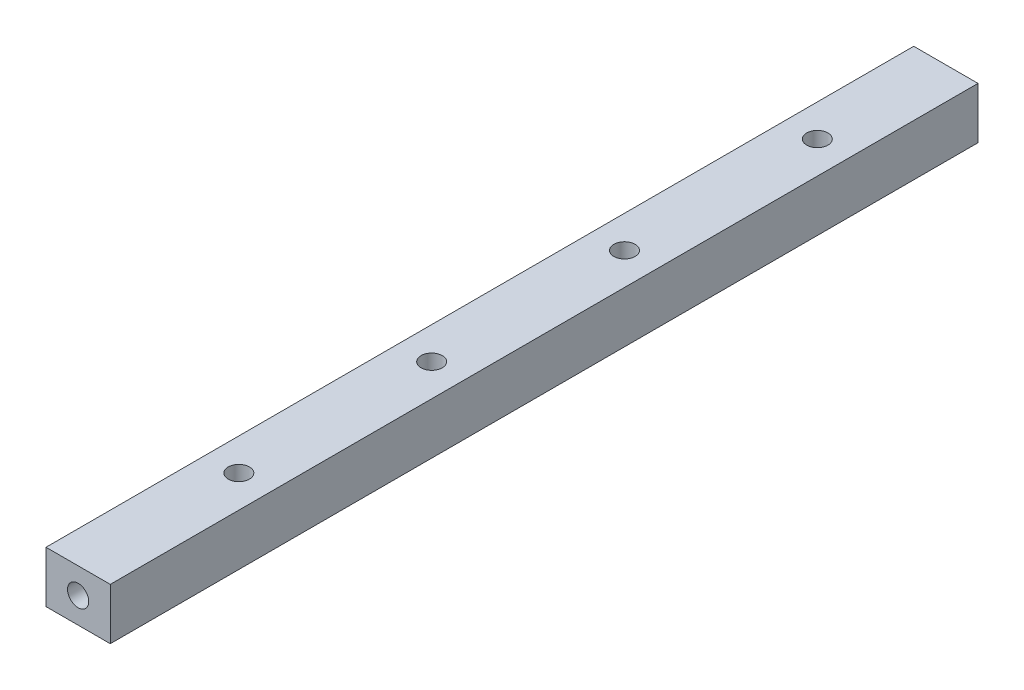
SolidWorks part; units mm, degrees
ref_plane "Plan de face" through (0, 0, 0) normal (0, 0, 1) x (1, 0, 0)
ref_plane "Plan de dessus" through (0, 0, 0) normal (0, 1, 0) x (1, 0, 0)
ref_plane "Plan de droite" through (0, 0, 0) normal (1, 0, 0) x (0, 0, -1)
sketch "Esquisse1" plane through (0, 0, 0) normal (0, 0, 1) x (1, 0, 0)
  line L1 (-5, 4) -> (5, 4)
  line L2 (-5, 4) -> (-5, -4)
  line L3 (-5, -4) -> (5, -4)
  line L4 (5, 4) -> (5, -4)
  dimension "D1" = 8
  dimension "D2" = 4
  dimension "D3" = 5
  dimension "D4" = 10
extrude "Boss.-Extru.1" add sketch "Esquisse1" along normal blind 135
hole_wizard "Trou taraudé M41" positions "Esquisse4" profile "Esquisse3" tap size "M4" standard "ISO"
sketch "Esquisse4" plane through (0, 0, 135) normal (0, 0, 1) x (1, 0, 0)
  point P0 (0, 0)
sketch "Esquisse3" plane through (0, 0, 135) normal (1, 0, 0) x (0, -1, 0)
  line L0 (0, 0) -> (0, 20.9914)
  line L1 (0, 20.9914) -> (1.65, 20)
  line L2 (1.65, 20) -> (1.65, 0)
  line L5 (1.65, 0) -> (0, 0)
  line L10 (0, 20.9914) -> (-1.65, 20) construction
  line L11 (0, -6.35) -> (0, 107.95) construction
  dimension "Diamètre du trou pour taraudage" = 3.3
  dimension "Profondeur du trou pour taraudage" = 20
  dimension "Angle de pointe" = 118
hole_wizard "Trou taraudé M42" positions "Esquisse7" profile "Esquisse6" tap size "M4" standard "ISO"
sketch "Esquisse7" plane through (0, 4, 0) normal (0, 1, 0) x (-1, 0, 0)
  line L0 (-5, 0) -> (5, 0) construction
  point P0 (0, 20)
  dimension "D1" = 20
sketch "Esquisse6" plane through (0, 4, 20) normal (1, 0, 0) x (0, 0, 1)
  line L0 (0, 0) -> (0, 8)
  line L1 (0, 8) -> (1.65, 8)
  line L2 (1.65, 8) -> (1.65, 0)
  line L5 (1.65, 0) -> (0, 0)
  line L11 (0, -6.35) -> (0, 107.95) construction
  dimension "Diamètre du trou pour taraudage jusqu'au prochain" = 3.3
  dimension "Profondeur du trou pour taraudage jusqu'au prochain" = 8
pattern_linear "Répétition linéaire1" count 4 spacing 30 along (0, 0, 1) of "Trou taraudé M42"
